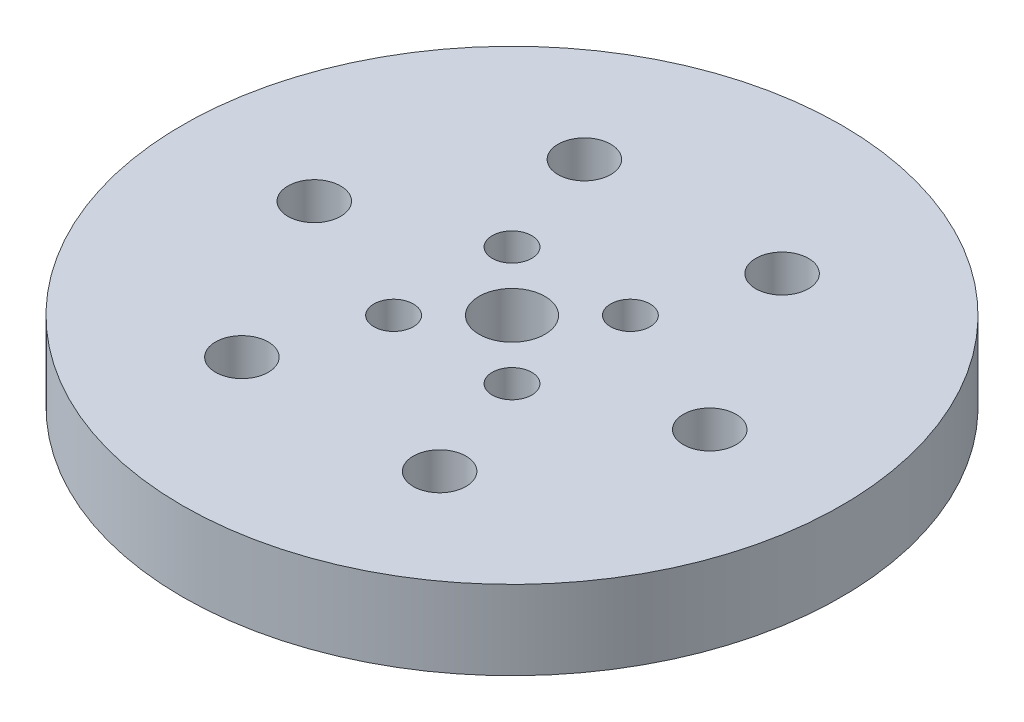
SolidWorks part; units mm, degrees
ref_plane "Front" through (0, 0, 0) normal (0, 0, 1) x (1, 0, 0)
ref_plane "Top" through (0, 0, 0) normal (0, 1, 0) x (1, 0, 0)
ref_plane "Right" through (0, 0, 0) normal (1, 0, 0) x (0, 0, -1)
sketch "Sketch1" plane through (0, 0, 0) normal (0, 1, 0) x (1, 0, 0)
  circle A0 centre (0, 0) radius 25
  dimension "D1" = 50
extrude "Boss-Extrude1" add sketch "Sketch1" along normal blind 6
sketch "Sketch2" plane through (0, 6, 0) normal (0, 1, 0) x (1, 0, 0)
  line L0 (-4.4901, 4.4901) -> (-4.4901, -4.4901) construction
  circle B0 centre (0, 0) radius 2.5
  circle B1 centre (-4.4901, 4.4901) radius 1.5
  circle B2 centre (4.4901, 4.4901) radius 1.5
  circle B3 centre (4.4901, -4.4901) radius 1.5
  circle B4 centre (-4.4901, -4.4901) radius 1.5
sketch_block_instance "Block-Pololu-1998-hub-mounting-1"
sketch_block "Block-Pololu-1998-hub-mounting" parameters "D1"=18, "D2"=5, "D4"=3, "D3"=12.7
extrude "hub mounting" cut sketch "Sketch2" against normal through all
sketch "Sketch3" plane through (0, 6, 0) normal (0, 1, 0) x (1, 0, 0)
  circle A0 centre (-15, 0) radius 2
  dimension "D1" = 4
  dimension "D2" = 15
extrude "dowel hole" cut sketch "Sketch3" against normal through all
pattern_circular "dowel pattern" count 6 over 360 about axis through (0, 0, 0) along (0, 1, 0) of "dowel hole"
